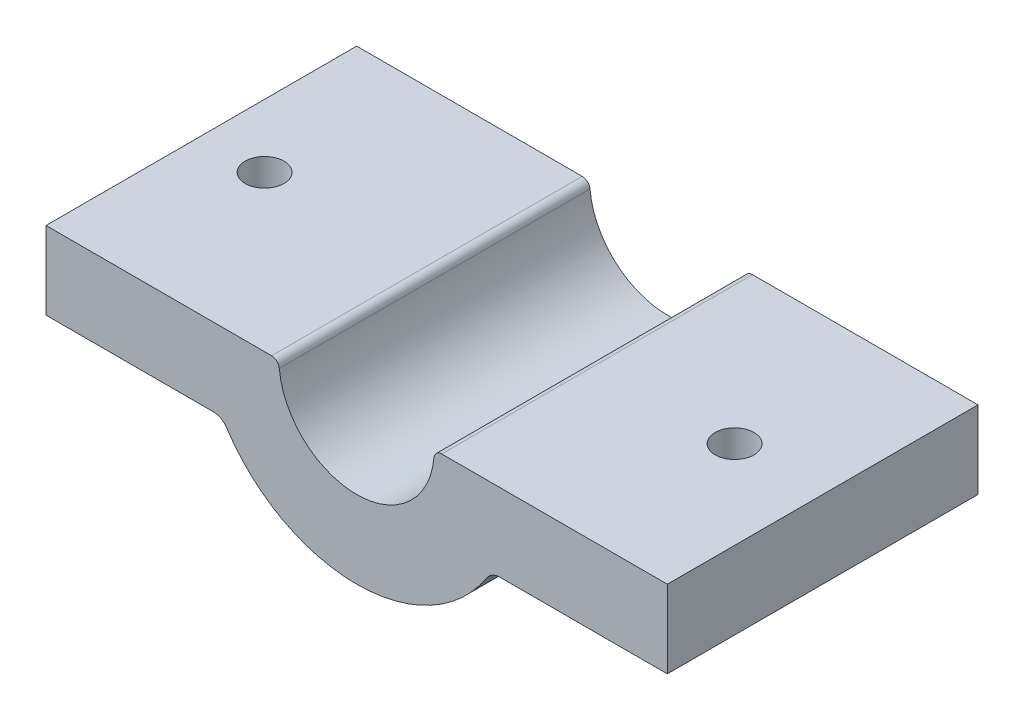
SolidWorks part; units mm, degrees
ref_plane "Front Plane" through (0, 0, 0) normal (0, 0, 1) x (1, 0, 0)
ref_plane "Top Plane" through (0, 0, 0) normal (0, 1, 0) x (1, 0, 0)
ref_plane "Right Plane" through (0, 0, 0) normal (1, 0, 0) x (0, 0, -1)
sketch "Sketch1" plane through (0, 0, 0) normal (0, 0, 1) x (1, 0, 0)
  line L0 (5.4772, 0) -> (20, 0)
  line L1 (-5.4772, 0) -> (-20, 0)
  line L2 (-8.6603, -5) -> (-20, -5)
  line L3 (8.6603, -5) -> (20, -5)
  line L4 (-20, 0) -> (-20, -5)
  line L5 (20, 0) -> (20, -5)
  arc A0 (-4.9793, -0.4545) -> (4.9793, -0.4545) centre (0, 0) ccw
  arc A1 (-5.4772, 0) -> (-4.9793, -0.4545) centre (-5.4772, -0.5) cw
  arc A2 (5.4772, 0) -> (4.9793, -0.4545) centre (5.4772, -0.5) ccw
  arc A3 (-8.6603, -5) -> (-8.6603, -5) centre (-8.6603, -5) cw
  arc A4 (-8.6603, -5) -> (8.6603, -5) centre (0, 0) ccw
  arc A5 (8.6603, -5) -> (8.6603, -5) centre (8.6603, -5) ccw
  point P14 (-5, 0)
  point P17 (5, 0)
  dimension "D1" = 10
  dimension "D4" = 0.5
  dimension "D5" = 0.5
  dimension "D2" = 15
  dimension "D3" = 15
  dimension "D6" = 5
extrude "Boss-Extrude1" add sketch "Sketch1" against normal blind 20
sketch "Sketch2" plane through (0, -5, 0) normal (0, -1, 0) x (1, 0, 0)
  line L0 (-20, -20) -> (-20, 0) construction
  line L1 (8.6603, 0) -> (20, 0) construction
  circle A0 centre (-15.9281, -10) radius 1.25
  circle A1 centre (14.3301, -10) radius 1.25
  point P6 (-20, -10)
  point P11 (14.3301, 0)
  dimension "D1" = 2.5
extrude "Cut-Extrude1" cut sketch "Sketch2" against normal blind 20
fillet "Fillet1" radius 1 2 edges at (-8.6603, -5, -10) (8.6603, -5, -10)
sketch "Sketch3" plane through (0, 0, 0) normal (0, 0, 1) x (1, 0, 0)
  circle A0 centre (0, 0) radius 5
  dimension "D1" = 10
